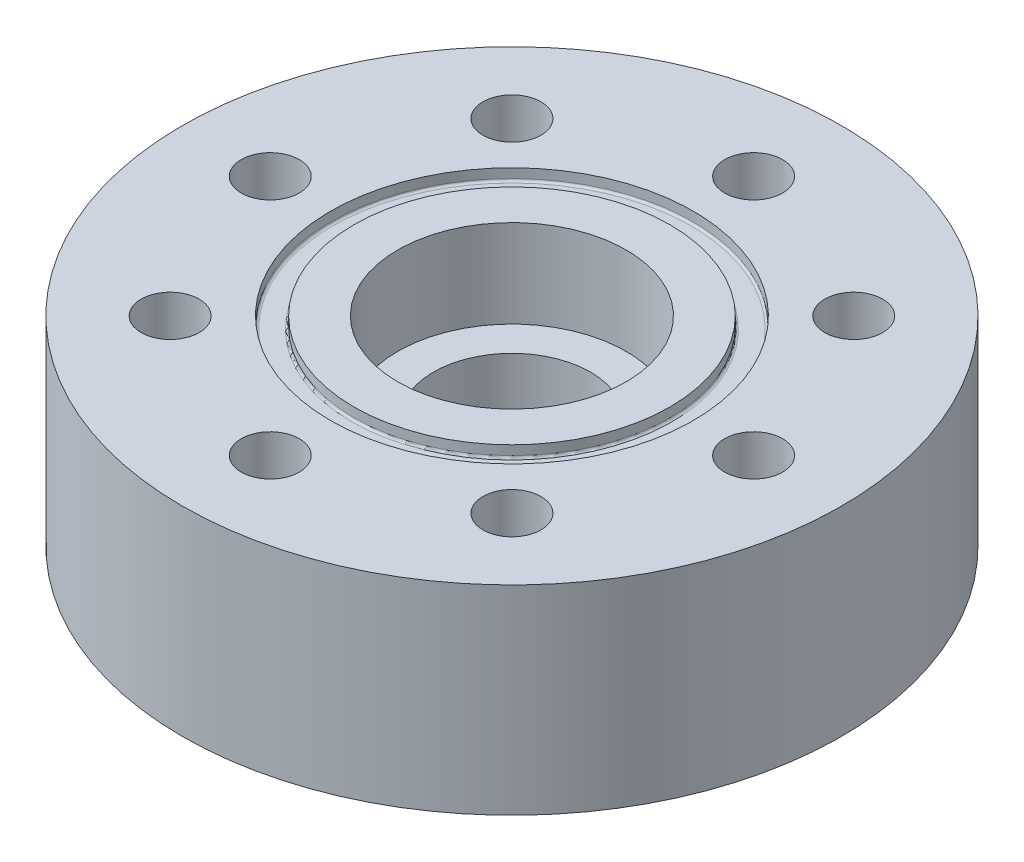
SolidWorks part; units mm, degrees
ref_plane "Front Plane" through (0, 0, 0) normal (0, 0, 1) x (1, 0, 0)
ref_plane "Top Plane" through (0, 0, 0) normal (0, 1, 0) x (1, 0, 0)
ref_plane "Right Plane" through (0, 0, 0) normal (1, 0, 0) x (0, 0, -1)
sketch "Sketch2" plane through (0, 0, 0) normal (0, 1, 0) x (1, 0, 0)
  circle A0 centre (0, 0) radius 37.5
  dimension "D1" = 75
extrude "Outer Cylinder" add sketch "Sketch2" along normal blind 22.7
sketch "Sketch3" plane through (0, 0, 0) normal (0, -1, 0) x (1, 0, 0)
  circle A0 centre (0, 0) radius 8.93
  dimension "D1" = 17.86
extrude "NPT Hole" cut sketch "Sketch3" against normal blind 12.7
sketch "Sketch4" plane through (0, 0, 0) normal (0, -1, 0) x (1, 0, 0)
  circle A0 centre (-27.5, 0) radius 3.3
  circle A1 centre (-19.4454, 19.4454) radius 3.3
  circle A2 centre (0, 27.5) radius 3.3
  circle A3 centre (19.4454, 19.4454) radius 3.3
  circle A4 centre (27.5, 0) radius 3.3
  circle A5 centre (19.4454, -19.4454) radius 3.3
  circle A6 centre (0, -27.5) radius 3.3
  circle A7 centre (-19.4454, -19.4454) radius 3.3
  point P19 (0, 0)
  dimension "D1" = 6.6
  dimension "D2" = 27.5
  dimension "D3" = 8
extrude "Bolt Holes" cut sketch "Sketch4" against normal through all
sketch "Sketch5" plane through (0, 22.7, 0) normal (0, 1, 0) x (1, 0, 0)
  circle A0 centre (0, 0) radius 17.9705
  circle A1 centre (0, 0) radius 20.6375
  dimension "D1" = 41.275
  dimension "D2" = 2.667
extrude "O-Ring Groove" cut sketch "Sketch5" against normal blind 1.3208
fillet "Fillet1" radius 0.254 2 edges at (0, 21.3792, 17.9705) (0, 21.3792, 20.6375)
sketch "Sketch6" plane through (0, 22.7, 0) normal (0, 1, 0) x (1, 0, 0)
  circle A0 centre (0, 0) radius 13
extrude "Inlet Flow Diameter" cut sketch "Sketch6" against normal blind 10
equation "\"D\"= 26"
equation "\"Inlet Flow Diameter\"= \"D\""
equation "\"D1@Sketch6\"=\"D\""
